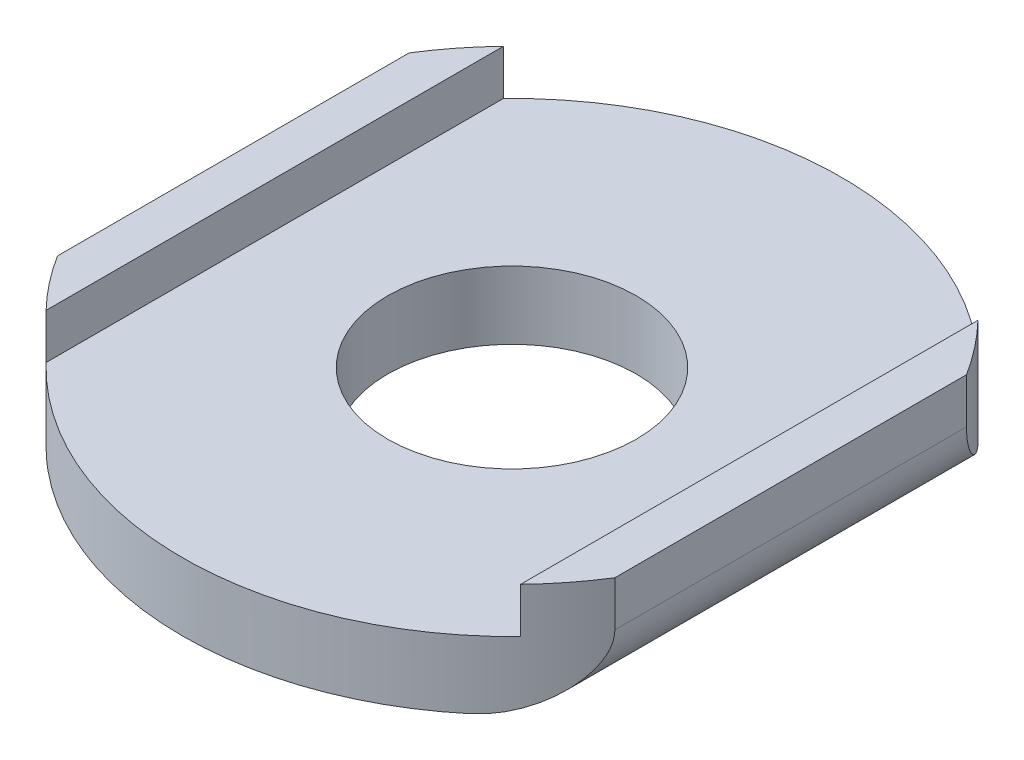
SolidWorks part; units mm, degrees
ref_plane "Plane1" through (0, 0, 0) normal (0, 0, 1) x (1, 0, 0)
ref_plane "Plane2" through (0, 0, 0) normal (0, 1, 0) x (-1, 0, 0)
ref_plane "Plane3" through (0, 0, 0) normal (1, 0, 0) x (0, 0, -1)
sketch "Sketch1" plane through (0, 0, 0) normal (0, 1, 0) x (-1, 0, 0)
  circle A0 centre (0, 0) radius 4.191
  circle A1 centre (0, 0) radius 11.1125
  dimension "D1" = 8.382
  dimension "D2" = 22.225
extrude "Base-Extrude" add sketch "Sketch1" along normal blind 2.286
sketch "Sketch2" plane through (0, 2.286, 0) normal (0, 1, 0) x (-1, 0, 0)
  line L0 (0, 0) -> (0, -6.4812) construction
  line L1 (9.398, -10.0275) -> (9.398, 12.01)
  line L2 (-9.398, -10.0275) -> (-9.398, 12.01)
  line L3 (-9.398, 12.01) -> (9.398, 12.01)
  dimension "D1" = 18.796
  dimension "D2" = 9.398
extrude "Cut-Extrude1" cut sketch "Sketch2" against normal through all
sketch "Sketch3" plane through (0, 2.286, 0) normal (0, 1, 0) x (-1, 0, 0)
  line L0 (9.398, -5.93) -> (9.398, 5.93) construction
  line L1 (-9.398, 5.93) -> (-9.398, -5.93) construction
  line L2 (8.001, -5.5113) -> (8.001, 5.5113)
  line L3 (-8.001, 5.5113) -> (-8.001, -5.5113)
  line L4 (8.001, -7.7118) -> (8.001, 7.7118)
  line L5 (-8.001, 7.7118) -> (-8.001, -7.7118)
  line L6 (9.398, -5.93) -> (9.398, 5.93)
  line L7 (-9.398, 5.93) -> (-9.398, -5.93)
  arc A0 (9.398, 5.93) -> (-9.398, 5.93) centre (0, 0) ccw construction
  arc A1 (-9.398, -5.93) -> (9.398, -5.93) centre (0, 0) ccw construction
  arc A2 (8.001, 5.5113) -> (-8.001, 5.5113) centre (0, 0) ccw
  arc A3 (-8.001, -5.5113) -> (8.001, -5.5113) centre (0, 0) ccw
  arc A4 (9.398, 5.93) -> (8.001, 7.7118) centre (0, 0) ccw
  arc A5 (-9.398, -5.93) -> (-8.001, -7.7118) centre (0, 0) ccw
  arc A6 (8.001, -7.7118) -> (9.398, -5.93) centre (0, 0) ccw
  arc A7 (-8.001, 7.7118) -> (-9.398, 5.93) centre (0, 0) ccw
  dimension "D1" = 1.397
extrude "Boss-Extrude1" add sketch "Sketch3" along normal blind 1.524
fillet "Fillet1" radius 2.286 2 edges at (9.398, 0, 0) (-9.398, 0, 0)
equation "\"D2@Sketch2\" = .74 / 2"
